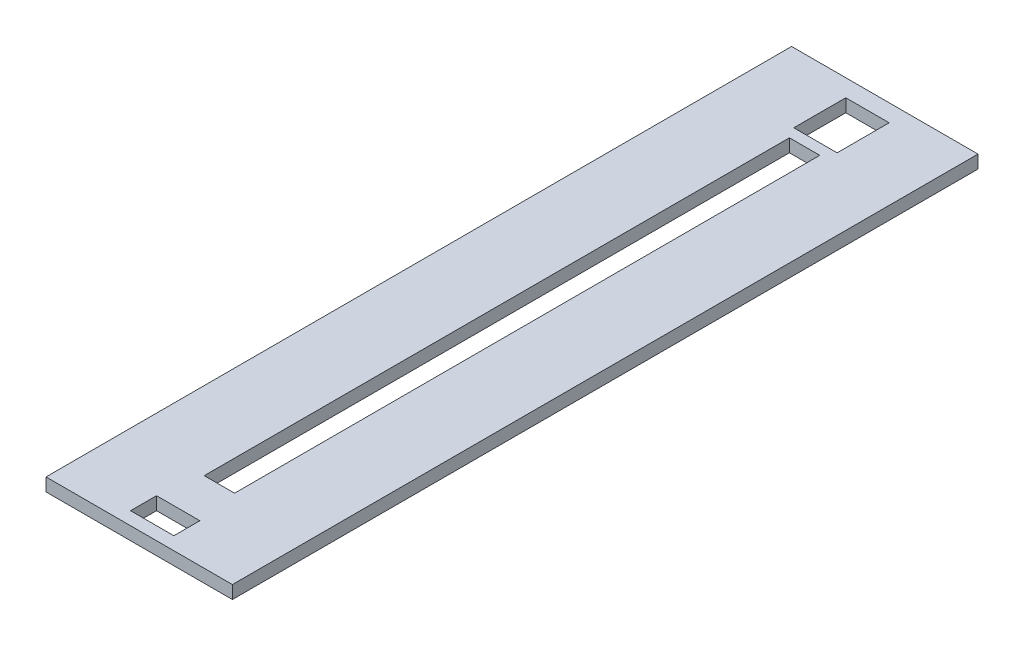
SolidWorks part; units mm, degrees
ref_plane "Front Plane" through (0, 0, 0) normal (0, 0, 1) x (1, 0, 0)
ref_plane "Top Plane" through (0, 0, 0) normal (0, 1, 0) x (1, 0, 0)
ref_plane "Right Plane" through (0, 0, 0) normal (1, 0, 0) x (0, 0, -1)
sketch "Sketch1" plane through (0, 0, 0) normal (0, 1, 0) x (1, 0, 0)
  line L1 (-21.5, 86) -> (21.5, 86)
  line L2 (-21.5, 86) -> (-21.5, -86)
  line L3 (-21.5, -86) -> (21.5, -86)
  line L4 (21.5, 86) -> (21.5, -86)
  line L5 (-21.5, 86) -> (21.5, -86) construction
  line L6 (-21.5, -86) -> (21.5, 86) construction
  line L7 (-5, 82) -> (5, 82)
  line L8 (-5, 82) -> (-5, 70)
  line L9 (-5, 70) -> (5, 70)
  line L10 (5, 82) -> (5, 70)
  line L11 (-5, 82) -> (5, 70) construction
  line L12 (-5, 70) -> (5, 82) construction
  line L13 (-3.5, 67.5) -> (3.5, 67.5)
  line L14 (-3.5, 67.5) -> (-3.5, -67.5)
  line L15 (-3.5, -67.5) -> (3.5, -67.5)
  line L16 (3.5, 67.5) -> (3.5, -67.5)
  line L17 (-3.5, 67.5) -> (3.5, -67.5) construction
  line L18 (-3.5, -67.5) -> (3.5, 67.5) construction
  line L19 (-5, -77) -> (5, -77)
  line L20 (-5, -77) -> (-5, -83)
  line L21 (-5, -83) -> (5, -83)
  line L22 (5, -77) -> (5, -83)
  line L23 (-5, -77) -> (5, -83) construction
  line L24 (-5, -83) -> (5, -77) construction
  point P0 (0, 0)
  point P6 (0, 76)
  point P11 (0, 0)
  point P16 (0, -80)
  dimension "D1" = 172
  dimension "D2" = 43
  dimension "D3" = 10
  dimension "D4" = 12
  dimension "D5" = 10
  dimension "D6" = 7
  dimension "D7" = 135
  dimension "D8" = 6
  dimension "D9" = 10
  dimension "D10" = 6
extrude "Boss-Extrude1" add sketch "Sketch1" along normal blind 3
